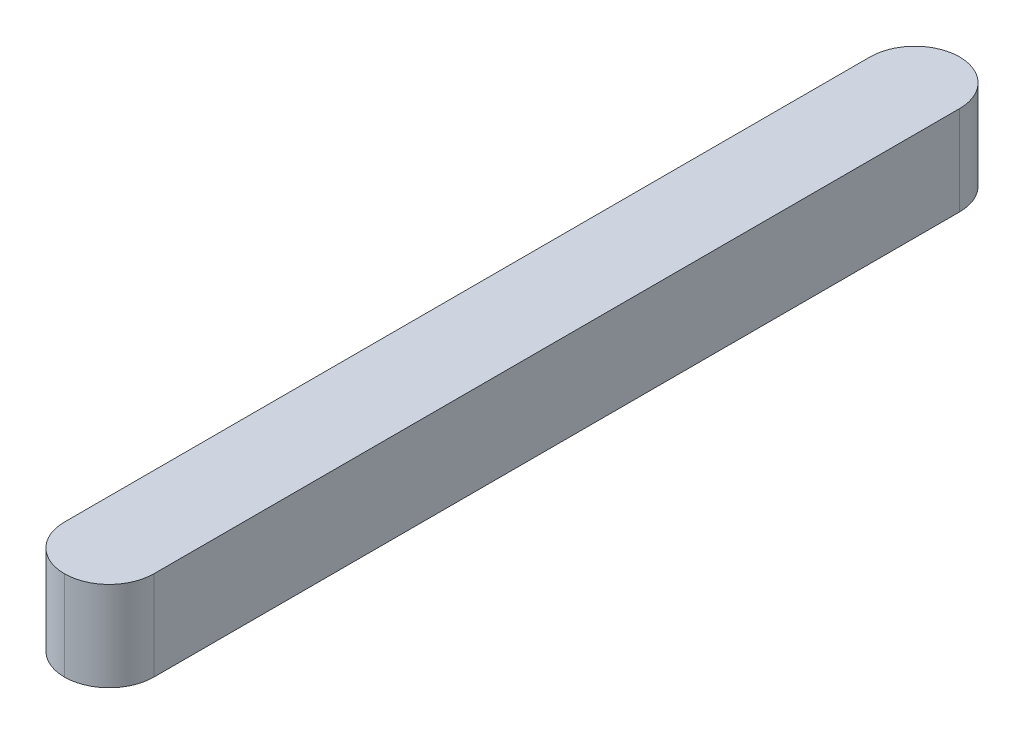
SolidWorks part; units mm, degrees
ref_plane "Plan1" through (0, 0, 0) normal (0, 0, 1) x (1, 0, 0)
ref_plane "Plan2" through (0, 0, 0) normal (0, 1, 0) x (1, 0, 0)
ref_plane "Plan3" through (0, 0, 0) normal (1, 0, 0) x (0, 0, -1)
sketch "Esquisse1" plane through (0, 0, 0) normal (0, 0, 1) x (1, 0, 0)
  line L1 (0, 0) -> (6, 0)
  line L2 (0, 0) -> (0, 6)
  line L3 (0, 6) -> (6, 6)
  line L4 (6, 0) -> (6, 6)
  dimension "D1" = 6
  dimension "D2" = 6
extrude "Base-Extrusion" add sketch "Esquisse1" along normal blind 60
fillet "Congé1" radius 3
